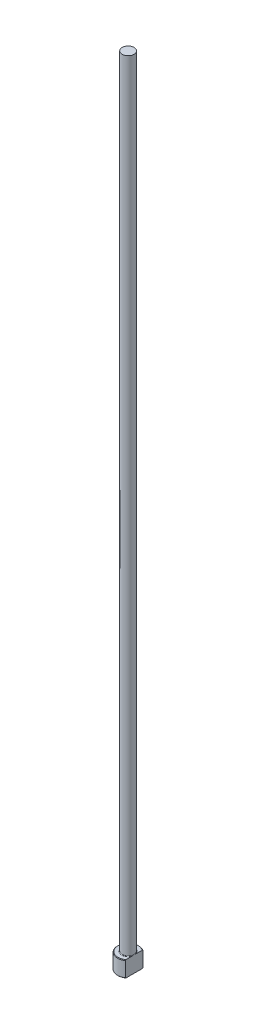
SolidWorks part; units mm, degrees
ref_plane "Front Plane" through (0, 0, 0) normal (0, 0, 1) x (1, 0, 0)
ref_plane "Top Plane" through (0, 0, 0) normal (0, 1, 0) x (1, 0, 0)
ref_plane "Right Plane" through (0, 0, 0) normal (1, 0, 0) x (0, 0, -1)
sketch "Sketch1" plane through (0, 0, 0) normal (0, 0, 1) x (1, 0, 0)
  line L0 (0, 259.9588) -> (0, -15.1925) construction
  line L1 (0, 0) -> (-4, 0)
  line L2 (-4, 0) -> (-4, 6)
  line L3 (-4, 6) -> (-2.25, 6)
  line L4 (-2.25, 6) -> (-2.25, 300)
  line L5 (-2.25, 300) -> (0, 300)
  line L6 (0, 300) -> (0, 0)
  dimension "L" = 300
  dimension "H" = 8
  dimension "T" = 6
  dimension "D" = 4.5
revolve "Revolve1" add sketch "Sketch1" angle 360 about L0
chamfer "Chamfer1" distance 0.2 angle 45 2 edges at (0, 6, 4) (0, 0, 4)
fillet "Fillet1" radius 0.2 1 edges at (0, 6, 2.25)
sketch "Sketch2" plane through (0, 0, 0) normal (0, 1, 0) x (1, 0, 0)
  line L0 (2.25, -3.3072) -> (2.25, 3.3072)
  circle A0 centre (0, 0) radius 4 construction
  arc A1 (2.25, -3.3072) -> (2.25, 3.3072) centre (0, 0) ccw
  circle A2 centre (0, 0) radius 2.25 construction
extrude "KEYED HEAD" cut sketch "Sketch2" along normal through all
